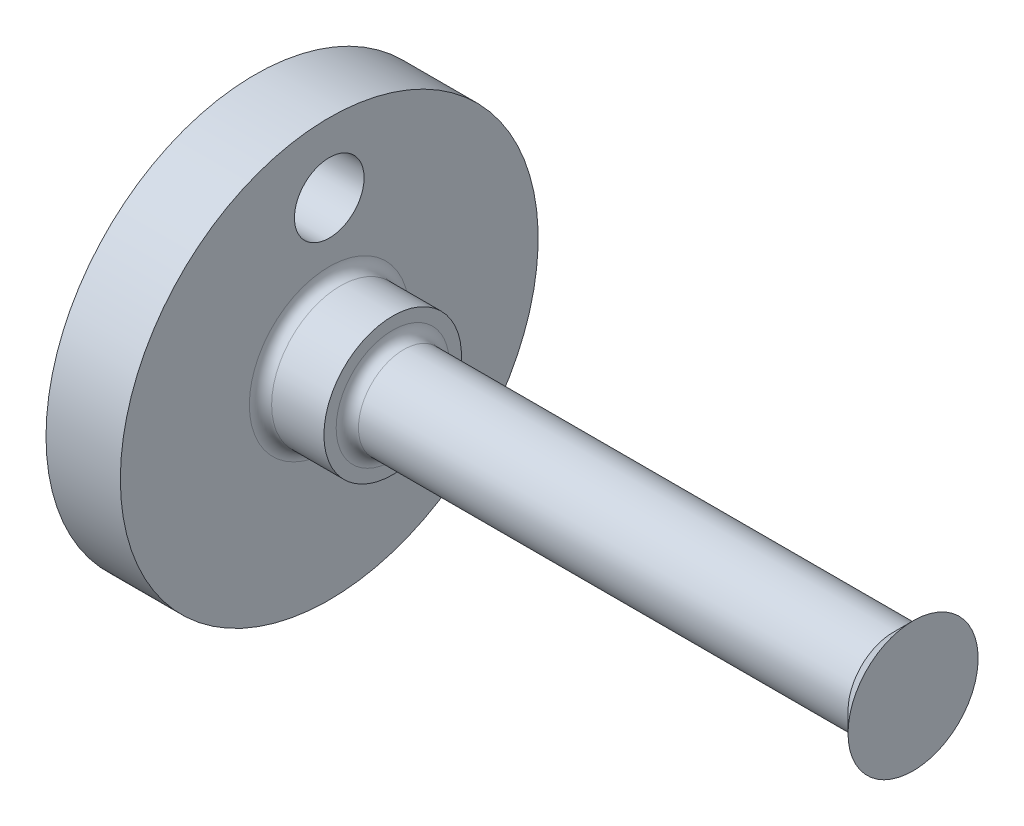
SolidWorks part; units mm, degrees
ref_plane "Front Plane" through (0, 0, 0) normal (0, 0, 1) x (1, 0, 0)
ref_plane "Top Plane" through (0, 0, 0) normal (0, 1, 0) x (1, 0, 0)
ref_plane "Right Plane" through (0, 0, 0) normal (1, 0, 0) x (0, 0, -1)
sketch "Sketch1" plane through (0, 0, 0) normal (0, 0, 1) x (1, 0, 0)
  line L0 (0, 0) -> (22.4866, 0)
  line L1 (0, 0) -> (22.4866, 0) construction
  line L2 (0, 0) -> (0, 8.6838) construction
  line L3 (0, 0) -> (0, 7.1374)
  line L4 (0, 7.1374) -> (2.54, 7.1374)
  line L5 (2.54, 7.1374) -> (2.54, 2.7305)
  line L6 (2.921, 2.3495) -> (4.7066, 2.3495)
  line L7 (4.7066, 2.3495) -> (4.7066, 1.9304)
  line L8 (5.0876, 1.5494) -> (21.8135, 1.5494)
  line L10 (22.4866, 2.2225) -> (21.8516, 1.5875) construction
  line L13 (22.4866, 0) -> (27.9413, 0) construction
  line L14 (22.4866, 0) -> (22.4866, 2.2225)
  line L15 (22.4866, 2.2225) -> (21.8135, 1.5494)
  arc A0 (4.7066, 1.9304) -> (5.0876, 1.5494) centre (5.0876, 1.9304) ccw
  arc A1 (2.54, 2.7305) -> (2.921, 2.3495) centre (2.921, 2.7305) ccw
  point P3 (3.8138, 2.3495)
  point P17 (2.54, 2.3495)
  dimension "D7" = 0.381
  dimension "D1" = 14.2748
  dimension "D2" = 4.699
  dimension "D3" = 3.0988
  dimension "D4" = 2.54
  dimension "D5" = 2.1666
  dimension "D6" = 17.78
  dimension "D8" = 4.445
  dimension "D9" = 4.445
  dimension "D10" = 45
revolve "Revolve1" add sketch "Sketch1" angle 360 about L0
sketch "Sketch3" plane through (2.54, 0, 0) normal (1, 0, 0) x (0, 0, -1)
  line L0 (0, 0) -> (0, 4.7625) construction
  circle A0 centre (0, 4.7625) radius 1.19
  dimension "D1" = 2.38
  dimension "D2" = 4.7625
extrude "Cut-Extrude2" cut sketch "Sketch3" against normal up to next
